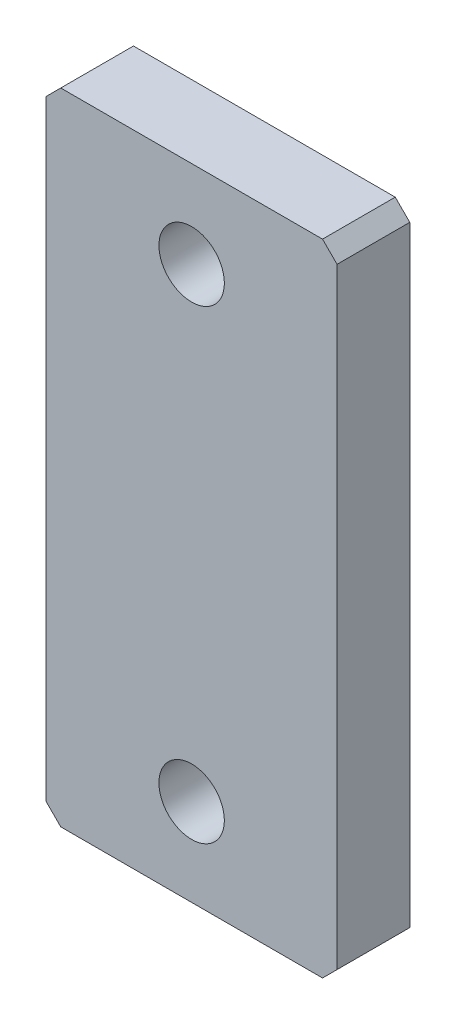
SolidWorks part; units mm, degrees
ref_plane "前视基准面" through (0, 0, 0) normal (0, 0, 1) x (1, 0, 0)
ref_plane "上视基准面" through (0, 0, 0) normal (0, 1, 0) x (1, 0, 0)
ref_plane "右视基准面" through (0, 0, 0) normal (1, 0, 0) x (0, 0, -1)
other "Configuration Table"
sketch "草图1" plane through (0, 0, 0) normal (0, 0, 1) x (1, 0, 0)
  line L0 (-9, -22) -> (9, -22)
  line L1 (9, -22) -> (10, -21)
  line L2 (10, -21) -> (10, 21)
  line L3 (10, 21) -> (9, 22)
  line L4 (9, 22) -> (-9, 22)
  line L5 (-9, 22) -> (-10, 21)
  line L6 (-10, 21) -> (-10, -21)
  line L7 (-10, -21) -> (-9, -22)
  circle A0 centre (0, -16) radius 2.25
  circle A1 centre (0, 16) radius 2.25
  dimension "D1" = 4.5
  dimension "D2" = 9
  dimension "D3" = 10
  dimension "D4" = 9
  dimension "D5" = 16
  dimension "D6" = 21
  dimension "D7" = 22
  dimension "D8" = 16
  dimension "D9" = 21
extrude "Bridge_over_existing_8mm_rail" add sketch "草图1" along normal blind 5
